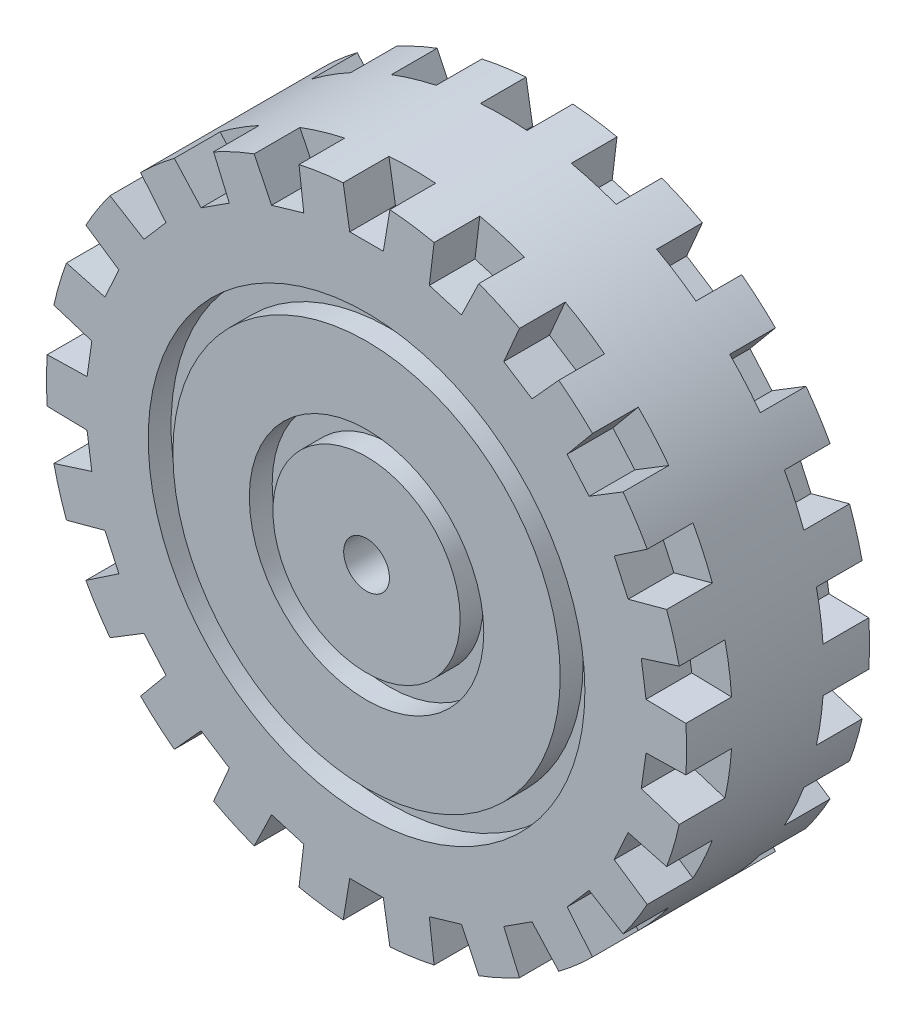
SolidWorks part; units mm, degrees
ref_plane "Front Plane" through (0, 0, 0) normal (0, 0, 1) x (1, 0, 0)
ref_plane "Top Plane" through (0, 0, 0) normal (0, 1, 0) x (1, 0, 0)
ref_plane "Right Plane" through (0, 0, 0) normal (1, 0, 0) x (0, 0, -1)
sketch "Sketch1" plane through (0, 0, 0) normal (0, 0, 1) x (1, 0, 0)
  circle A0 centre (0, 0) radius 2
  circle A1 centre (0, 0) radius 28
  dimension "D1" = 4
  dimension "D2" = 56
extrude "Extrude1" add sketch "Sketch1" along normal mid plane 16
sketch "Sketch2" plane through (0, 0, 8) normal (0, 0, 1) x (1, 0, 0)
  line L0 (0, 0) -> (0, 29.4612) construction
  line L1 (-1.4693, 24.4882) -> (1.4693, 24.4882)
  line L2 (1.4693, 24.4882) -> (2.2981, 29.4612)
  line L3 (2.2981, 29.4612) -> (-2.2981, 29.4612)
  line L4 (-1.4693, 24.4882) -> (-2.2981, 29.4612)
  line L5 (5.4894, 23.9102) -> (6.0951, 28.9153)
  line L6 (8.3089, 23.0823) -> (10.5052, 27.6204)
  line L7 (10.5052, 27.6204) -> (6.0951, 28.9153)
  line L8 (5.4894, 23.9102) -> (8.3089, 23.0823)
  line L9 (12.0033, 21.3952) -> (13.9946, 26.0268)
  line L10 (14.4754, 19.8064) -> (17.8612, 23.5419)
  line L11 (17.8612, 23.5419) -> (13.9946, 26.0268)
  line L12 (12.0033, 21.3952) -> (14.4754, 19.8064)
  line L13 (17.5448, 17.1468) -> (20.7604, 21.0298)
  line L14 (19.4691, 14.926) -> (23.7703, 17.5562)
  line L15 (23.7703, 17.5562) -> (20.7604, 21.0298)
  line L16 (17.5448, 17.1468) -> (19.4691, 14.926)
  line L17 (21.6649, 11.5093) -> (25.8442, 14.3291)
  line L18 (22.8856, 8.8363) -> (27.7535, 10.1482)
  line L19 (27.7535, 10.1482) -> (25.8442, 14.3291)
  line L20 (21.6649, 11.5093) -> (22.8856, 8.8363)
  line L21 (24.0299, 4.9394) -> (28.8343, 6.4675)
  line L22 (24.4481, 2.0307) -> (29.4884, 1.918)
  line L23 (29.4884, 1.918) -> (28.8343, 6.4675)
  line L24 (24.0299, 4.9394) -> (24.4481, 2.0307)
  line L25 (24.4481, -2.0307) -> (29.4884, -1.918)
  line L26 (24.0299, -4.9394) -> (28.8343, -6.4675)
  line L27 (28.8343, -6.4675) -> (29.4884, -1.918)
  line L28 (24.4481, -2.0307) -> (24.0299, -4.9394)
  line L29 (22.8856, -8.8363) -> (27.7535, -10.1482)
  line L30 (21.6649, -11.5093) -> (25.8442, -14.3291)
  line L31 (25.8442, -14.3291) -> (27.7535, -10.1482)
  line L32 (22.8856, -8.8363) -> (21.6649, -11.5093)
  line L33 (19.4691, -14.926) -> (23.7703, -17.5562)
  line L34 (17.5448, -17.1468) -> (20.7604, -21.0298)
  line L35 (20.7604, -21.0298) -> (23.7703, -17.5562)
  line L36 (19.4691, -14.926) -> (17.5448, -17.1468)
  line L37 (14.4754, -19.8064) -> (17.8612, -23.5419)
  line L38 (12.0033, -21.3952) -> (13.9946, -26.0268)
  line L39 (13.9946, -26.0268) -> (17.8612, -23.5419)
  line L40 (14.4754, -19.8064) -> (12.0033, -21.3952)
  line L41 (8.3089, -23.0823) -> (10.5052, -27.6204)
  line L42 (5.4894, -23.9102) -> (6.0951, -28.9153)
  line L43 (6.0951, -28.9153) -> (10.5052, -27.6204)
  line L44 (8.3089, -23.0823) -> (5.4894, -23.9102)
  line L45 (1.4693, -24.4882) -> (2.2981, -29.4612)
  line L46 (-1.4693, -24.4882) -> (-2.2981, -29.4612)
  line L47 (-2.2981, -29.4612) -> (2.2981, -29.4612)
  line L48 (1.4693, -24.4882) -> (-1.4693, -24.4882)
  line L49 (-5.4894, -23.9102) -> (-6.0951, -28.9153)
  line L50 (-8.3089, -23.0823) -> (-10.5052, -27.6204)
  line L51 (-10.5052, -27.6204) -> (-6.0951, -28.9153)
  line L52 (-5.4894, -23.9102) -> (-8.3089, -23.0823)
  line L53 (-12.0033, -21.3952) -> (-13.9946, -26.0268)
  line L54 (-14.4754, -19.8064) -> (-17.8612, -23.5419)
  line L55 (-17.8612, -23.5419) -> (-13.9946, -26.0268)
  line L56 (-12.0033, -21.3952) -> (-14.4754, -19.8064)
  line L57 (-17.5448, -17.1468) -> (-20.7604, -21.0298)
  line L58 (-19.4691, -14.926) -> (-23.7703, -17.5562)
  line L59 (-23.7703, -17.5562) -> (-20.7604, -21.0298)
  line L60 (-17.5448, -17.1468) -> (-19.4691, -14.926)
  line L61 (-21.6649, -11.5093) -> (-25.8442, -14.3291)
  line L62 (-22.8856, -8.8363) -> (-27.7535, -10.1482)
  line L63 (-27.7535, -10.1482) -> (-25.8442, -14.3291)
  line L64 (-21.6649, -11.5093) -> (-22.8856, -8.8363)
  line L65 (-24.0299, -4.9394) -> (-28.8343, -6.4675)
  line L66 (-24.4481, -2.0307) -> (-29.4884, -1.918)
  line L67 (-29.4884, -1.918) -> (-28.8343, -6.4675)
  line L68 (-24.0299, -4.9394) -> (-24.4481, -2.0307)
  line L69 (-24.4481, 2.0307) -> (-29.4884, 1.918)
  line L70 (-24.0299, 4.9394) -> (-28.8343, 6.4675)
  line L71 (-28.8343, 6.4675) -> (-29.4884, 1.918)
  line L72 (-24.4481, 2.0307) -> (-24.0299, 4.9394)
  line L73 (-22.8856, 8.8363) -> (-27.7535, 10.1482)
  line L74 (-21.6649, 11.5093) -> (-25.8442, 14.3291)
  line L75 (-25.8442, 14.3291) -> (-27.7535, 10.1482)
  line L76 (-22.8856, 8.8363) -> (-21.6649, 11.5093)
  line L77 (-19.4691, 14.926) -> (-23.7703, 17.5562)
  line L78 (-17.5448, 17.1468) -> (-20.7604, 21.0298)
  line L79 (-20.7604, 21.0298) -> (-23.7703, 17.5562)
  line L80 (-19.4691, 14.926) -> (-17.5448, 17.1468)
  line L81 (-14.4754, 19.8064) -> (-17.8612, 23.5419)
  line L82 (-12.0033, 21.3952) -> (-13.9946, 26.0268)
  line L83 (-13.9946, 26.0268) -> (-17.8612, 23.5419)
  line L84 (-14.4754, 19.8064) -> (-12.0033, 21.3952)
  line L85 (-8.3089, 23.0823) -> (-10.5052, 27.6204)
  line L86 (-5.4894, 23.9102) -> (-6.0951, 28.9153)
  line L87 (-6.0951, 28.9153) -> (-10.5052, 27.6204)
  line L88 (-8.3089, 23.0823) -> (-5.4894, 23.9102)
  point P7 (0, 24.4882)
extrude "Extrude2" cut sketch "Sketch2" against normal blind 4
mirror "Mirror1" about plane through (0, 0, 0) normal (0, 0, 1) of "Extrude2"
sketch "Sketch3" plane through (0, 0, -8) normal (0, 0, -1) x (-1, 0, 0)
  line L0 (0, 0) -> (0, 22.6912) construction
  line L1 (2.0742, 3.742) -> (11.0009, 19.8461)
  line L2 (-2.0742, 3.742) -> (-11.0009, 19.8461)
  line L3 (4.2778, 0.0747) -> (22.6877, 0.396)
  line L4 (2.2036, 3.6674) -> (11.6868, 19.4501)
  line L5 (2.2036, -3.6674) -> (11.6868, -19.4501)
  line L6 (4.2778, -0.0747) -> (22.6877, -0.396)
  line L7 (-2.0742, -3.742) -> (-11.0009, -19.8461)
  line L8 (2.0742, -3.742) -> (11.0009, -19.8461)
  line L9 (-4.2778, -0.0747) -> (-22.6877, -0.396)
  line L10 (-2.2036, -3.6674) -> (-11.6868, -19.4501)
  line L11 (-2.2036, 3.6674) -> (-11.6868, 19.4501)
  line L12 (-4.2778, 0.0747) -> (-22.6877, 0.396)
  arc A0 (11.0009, 19.8461) -> (-11.0009, 19.8461) centre (0, 0) ccw
  arc A1 (2.0742, 3.742) -> (-2.0742, 3.742) centre (0, 0) ccw
  arc A2 (4.2778, 0.0747) -> (2.2036, 3.6674) centre (0, 0) ccw
  arc A3 (22.6877, 0.396) -> (11.6868, 19.4501) centre (0, 0) ccw
  arc A4 (2.2036, -3.6674) -> (4.2778, -0.0747) centre (0, 0) ccw
  arc A5 (11.6868, -19.4501) -> (22.6877, -0.396) centre (0, 0) ccw
  arc A6 (-2.0742, -3.742) -> (2.0742, -3.742) centre (0, 0) ccw
  arc A7 (-11.0009, -19.8461) -> (11.0009, -19.8461) centre (0, 0) ccw
  arc A8 (-4.2778, -0.0747) -> (-2.2036, -3.6674) centre (0, 0) ccw
  arc A9 (-22.6877, -0.396) -> (-11.6868, -19.4501) centre (0, 0) ccw
  arc A10 (-2.2036, 3.6674) -> (-4.2778, 0.0747) centre (0, 0) ccw
  arc A11 (-11.6868, 19.4501) -> (-22.6877, 0.396) centre (0, 0) ccw
  dimension "D1" = 29
extrude "Extrude3" cut sketch "Sketch3" against normal blind 10
sketch "Sketch4" plane through (0, 0, 8) normal (0, 0, 1) x (1, 0, 0)
  circle A0 centre (0, 0) radius 8.1907
  circle A1 centre (0, 0) radius 10.2547
  circle A2 centre (0, 0) radius 16.9421
  circle A3 centre (0, 0) radius 19.1002
extrude "Extrude4" cut sketch "Sketch4" against normal blind 2 contours A1 A0 | A3 A2
